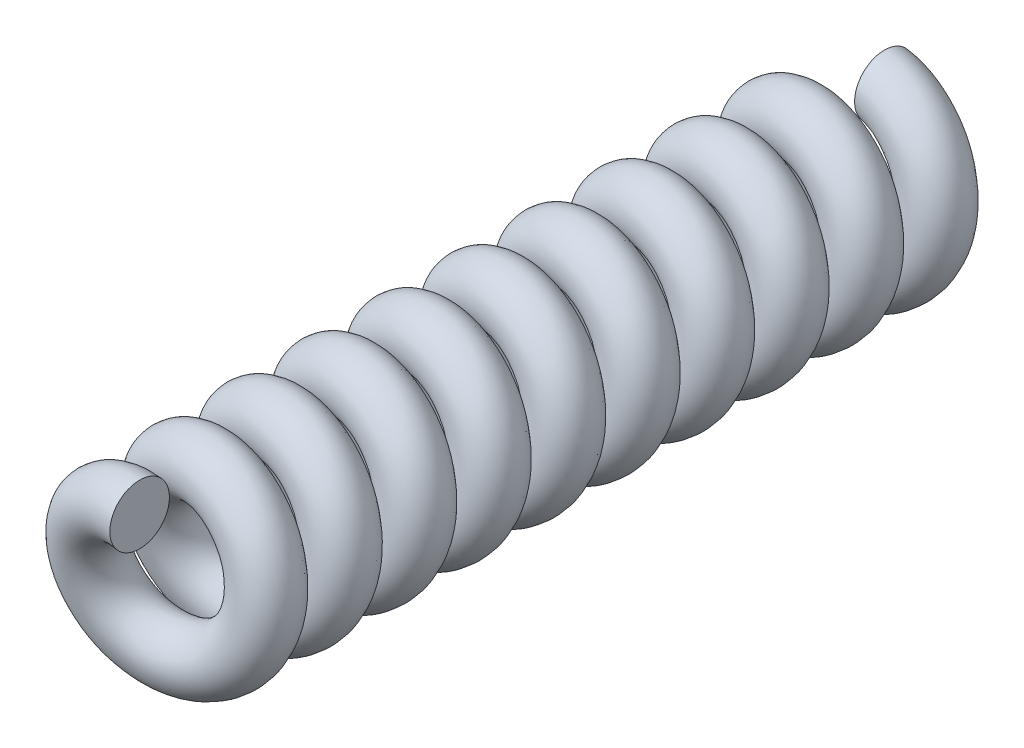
SolidWorks part; units mm, degrees
ref_plane "Přední rovina" through (0, 0, 0) normal (0, 0, 1) x (1, 0, 0)
ref_plane "Horní rovina" through (0, 0, 0) normal (0, 1, 0) x (1, 0, 0)
ref_plane "Pravá rovina" through (0, 0, 0) normal (1, 0, 0) x (0, 0, -1)
sketch "Skica1" plane through (0, 0, 0) normal (0, 0, 1) x (1, 0, 0)
  circle A0 centre (0, 0) radius 1.4
  dimension "D1" = 2.8
curve "Šroubovice/spirála1"
sketch "Skica2" plane through (0, 0, 0) normal (1, 0, 0) x (0, 0, -1)
  line L0 (0, 1.4) -> (0, 0) construction
  circle A0 centre (0, 1.4) radius 0.6
  spline S0 degree 3 number of poles 163 (0, 1.4) -> (-15, 1.4) construction
  dimension "D1" = 1.2
  dimension "D2" = 1.4
sweep "Táhnout po křivce1" add profiles "Skica2" path "Šroubovice/spirála1"
